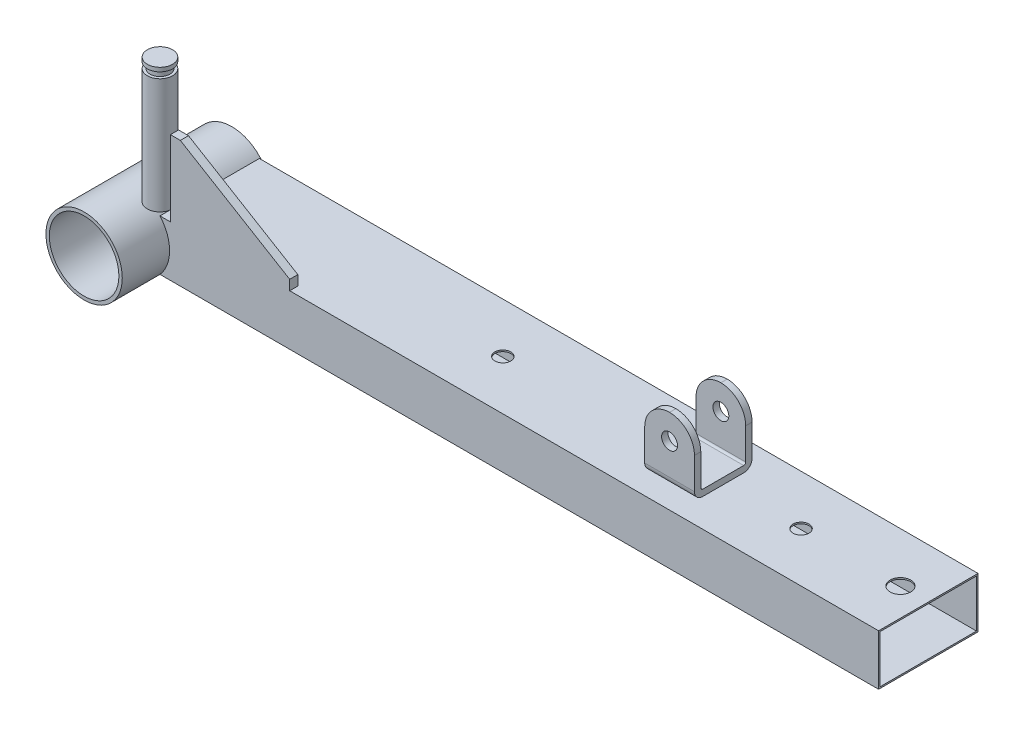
SolidWorks part; units mm, degrees
ref_plane "Plan1" through (0, 0, 0) normal (0, 0, 1) x (1, 0, 0)
ref_plane "Plan2" through (0, 0, 0) normal (0, 1, 0) x (1, 0, 0)
ref_plane "Plan3" through (0, 0, 0) normal (1, 0, 0) x (0, 0, -1)
sketch "Esquisse1" plane through (0, 0, 0) normal (0, 0, 1) x (1, 0, 0)
  circle A0 centre (0, 0) radius 19.2
  circle A1 centre (0, 0) radius 17.5
  dimension "D1" = 38.4
  dimension "D2" = 35
extrude "Base-Extrusion" add sketch "Esquisse1" along normal blind 74.3
ref_plane "Plan4" through (375.8, 0, 0) normal (1, 0, 0) x (0, 0, -1)
sketch "Esquisse2" plane through (375.8, 0, 0) normal (1, 0, 0) x (0, 0, -1)
  line L0 (0, -19.2) -> (0, 19.2) construction
  line L1 (-0.5, 12.75) -> (-50.5, 12.75)
  line L2 (-0.5, 12.75) -> (-0.5, -12.75)
  line L3 (-0.5, -12.75) -> (-50.5, -12.75)
  line L4 (-50.5, 12.75) -> (-50.5, -12.75)
  line L5 (-1.25, 12) -> (-49.75, 12)
  line L6 (-49.75, 12) -> (-49.75, -12)
  line L7 (-1.25, -12) -> (-49.75, -12)
  line L8 (-1.25, 12) -> (-1.25, -12)
  dimension "D1" = 50
  dimension "D2" = 25.5
  dimension "D3" = 0.5
  dimension "D4" = 12.75
  dimension "D5" = 0.75
extrude "Boss.-Extru.1" add sketch "Esquisse2" against normal up to next
ref_plane "Plan5" through (273.1, 0, 0) normal (1, 0, 0) x (0, 0, -1)
sketch "Esquisse9" plane through (273.1, 0, 0) normal (1, 0, 0) x (0, 0, -1)
  line L0 (-36.2345, 12.75) -> (-15.6345, 12.75)
  line L1 (-11.4345, 16.95) -> (-11.4345, 45.25)
  line L2 (-40.4345, 16.95) -> (-40.4345, 45.25)
  line L3 (-37.2345, 16.95) -> (-37.2345, 45.25)
  line L4 (-36.2345, 15.95) -> (-15.6345, 15.95)
  line L5 (-14.6345, 16.95) -> (-14.6345, 45.25)
  line L6 (-40.4345, 45.25) -> (-37.2345, 45.25)
  line L7 (-14.6345, 45.25) -> (-11.4345, 45.25)
  arc A0 (-37.2345, 16.95) -> (-36.2345, 15.95) centre (-36.2345, 16.95) ccw
  arc A1 (-15.6345, 15.95) -> (-14.6345, 16.95) centre (-15.6345, 16.95) ccw
  arc A2 (-36.2345, 12.75) -> (-40.4345, 16.95) centre (-36.2345, 16.95) cw
  arc A3 (-15.6345, 12.75) -> (-11.4345, 16.95) centre (-15.6345, 16.95) ccw
  point P15 (-40.4345, 12.75)
  point P18 (-11.4345, 12.75)
  dimension "D5" = 1
  dimension "D6" = 4.2
  dimension "D2" = 29
  dimension "D3" = 32.5
  dimension "D1" = 32.5
  dimension "D4" = 3.2
extrude "Boss.-Extru.7" add sketch "Esquisse9" against normal blind 25
fillet "Congé7" radius 12.5
other "Perçage1"
sketch "Esquisse10" plane through (0, 0, 40.4345) normal (0, 0, 1) x (1, 0, 0)
  circle A0 centre (260.6, 32.75) radius 4
  arc A1 (273.1, 32.75) -> (260.6, 45.25) centre (260.6, 32.75) ccw construction
  dimension "D1" = 8
ref_plane "Plan6" through (0, 17.75, 0) normal (0, 1, 0) x (-1, 0, 0)
sketch "Esquisse11" plane through (0, 17.75, 0) normal (0, 1, 0) x (-1, 0, 0)
  line L0 (19.2, 74.3) -> (-19.2, 74.3) construction
  line L1 (-375.8, 50.5) -> (-375.8, 0.5) construction
  circle A0 centre (-13.15, 49.3) radius 6.35
  dimension "D1" = 12.7
  dimension "D2" = 25
  dimension "D3" = 362.65
extrude "Boss.-Extru.11" add sketch "Esquisse11" along normal blind 58
sketch "Esquisse12" plane through (0, 75.75, 0) normal (0, 1, 0) x (-1, 0, 0)
  circle A0 centre (-13.15, 49.3) radius 5
  circle A1 centre (-13.15, 49.3) radius 6.35 construction
  dimension "D1" = 10
extrude "Boss.-Extru.12" add sketch "Esquisse12" along normal blind 3
sketch "Esquisse13" plane through (0, 78.75, 0) normal (0, 1, 0) x (-1, 0, 0)
  circle A0 centre (-13.15, 49.3) radius 6.35
  dimension "D1" = 12.7
extrude "Boss.-Extru.13" add sketch "Esquisse13" along normal blind 2
sketch "Esquisse14" plane through (0, 0, 50.5) normal (0, 0, 1) x (1, 0, 0)
  line L0 (19.6, 12.75) -> (79.6, 12.75)
  line L1 (14.3554, 12.75) -> (375.8, 12.75) construction
  line L2 (79.6, 12.75) -> (79.6, 17.75)
  line L3 (19.6, 12.75) -> (19.6, 50.75)
  line L4 (19.6, 50.75) -> (24.6, 50.75)
  line L5 (24.6, 50.75) -> (79.6, 17.75)
  circle A0 centre (0, 0) radius 17.5 construction
  dimension "D1" = 60
  dimension "D2" = 5
  dimension "D3" = 5
  dimension "D4" = 38
  dimension "D5" = 19.6
extrude "Boss.-Extru.14" add sketch "Esquisse14" against normal blind 4.1
other "Perçage2"
sketch "Esquisse16" plane through (0, 12.75, 0) normal (0, 1, 0) x (-1, 0, 0)
  line L0 (-375.8, 0.5) -> (-375.8, 50.5) construction
  line L1 (-79.6, 50.5) -> (-375.8, 50.5) construction
  circle A0 centre (-311.8, 25.5) radius 4
  dimension "D1" = 8
  dimension "D2" = 64
  dimension "D3" = 25
other "Perçage3"
sketch "Esquisse17" plane through (0, -12.75, 0) normal (0, -1, 0) x (1, 0, 0)
  circle A0 centre (311.8, 25.5) radius 5.75
  circle A2 centre (311.8, 25.5) radius 4 construction
  dimension "D1" = 11.5
other "Perçage4"
sketch "Esquisse18" plane through (0, 12.75, 0) normal (0, 1, 0) x (-1, 0, 0)
  line L0 (-375.8, 0.5) -> (-375.8, 50.5) construction
  line L1 (-79.6, 50.5) -> (-375.8, 50.5) construction
  circle A0 centre (-361.8, 25.5) radius 5.2
  dimension "D1" = 10.4
  dimension "D2" = 14
  dimension "D3" = 25
pattern_linear "Répétition linéaire1" count 2 spacing 150
